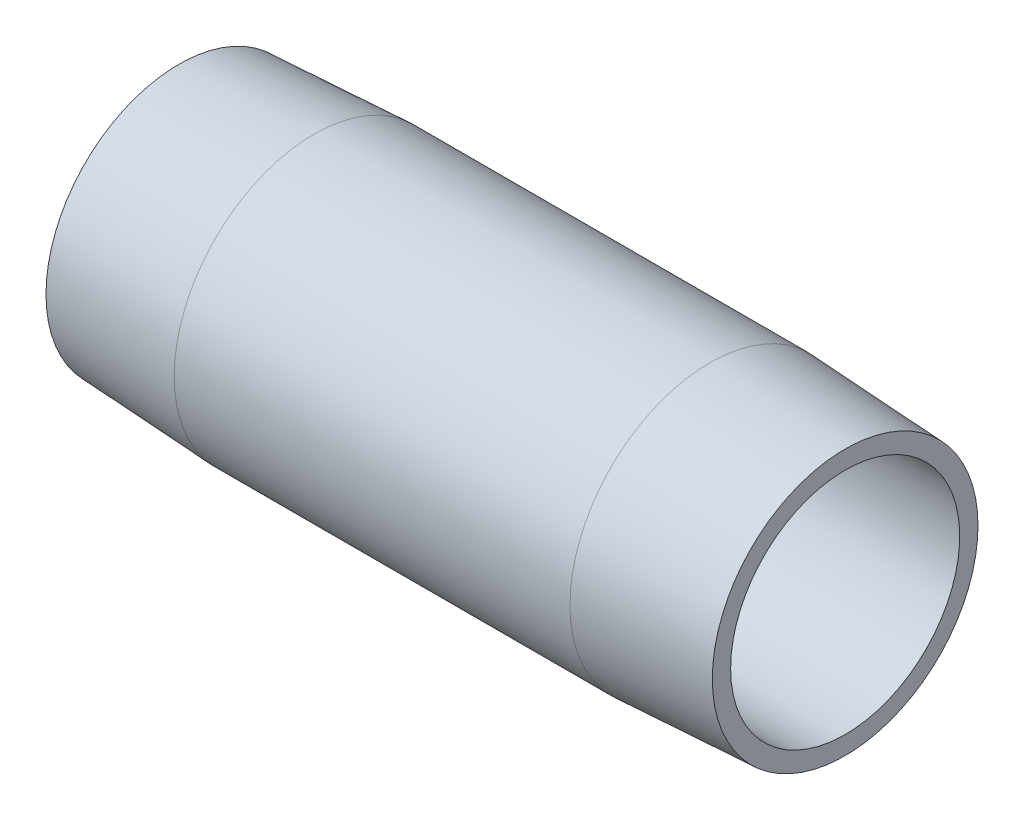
SolidWorks part; units mm, degrees
ref_plane "Front Plane" through (0, 0, 0) normal (0, 0, 1) x (1, 0, 0)
ref_plane "Top Plane" through (0, 0, 0) normal (0, 1, 0) x (1, 0, 0)
ref_plane "Right Plane" through (0, 0, 0) normal (1, 0, 0) x (0, 0, -1)
sketch "Sketch1" plane through (0, 0, 0) normal (0, 0, 1) x (1, 0, 0)
  line L6 (50.8, 8.7313) -> (0, 8.7313)
  line L7 (10.3124, 10.668) -> (0, 10.1276)
  line L8 (40.4876, 10.668) -> (10.3124, 10.668)
  line L9 (50.8, 10.1276) -> (40.4876, 10.668)
  line L10 (50.8, 8.7313) -> (50.8, 10.1276)
  line L11 (0, 10.1276) -> (0, 8.7313)
  line L12 (0, 0) -> (50000, 0) construction
  line L13 (0, -11.7348) -> (0, 11.7348) construction
  dimension "D1" = 50.8
  dimension "D2" = 3
  dimension "D3" = 3
  dimension "D4" = 21.336
  dimension "D5" = 17.4625
  dimension "D6" = 10.3124
  dimension "D7" = 10.3124
revolve "Revolve1" add sketch "Sketch1" angle 360 about L12
